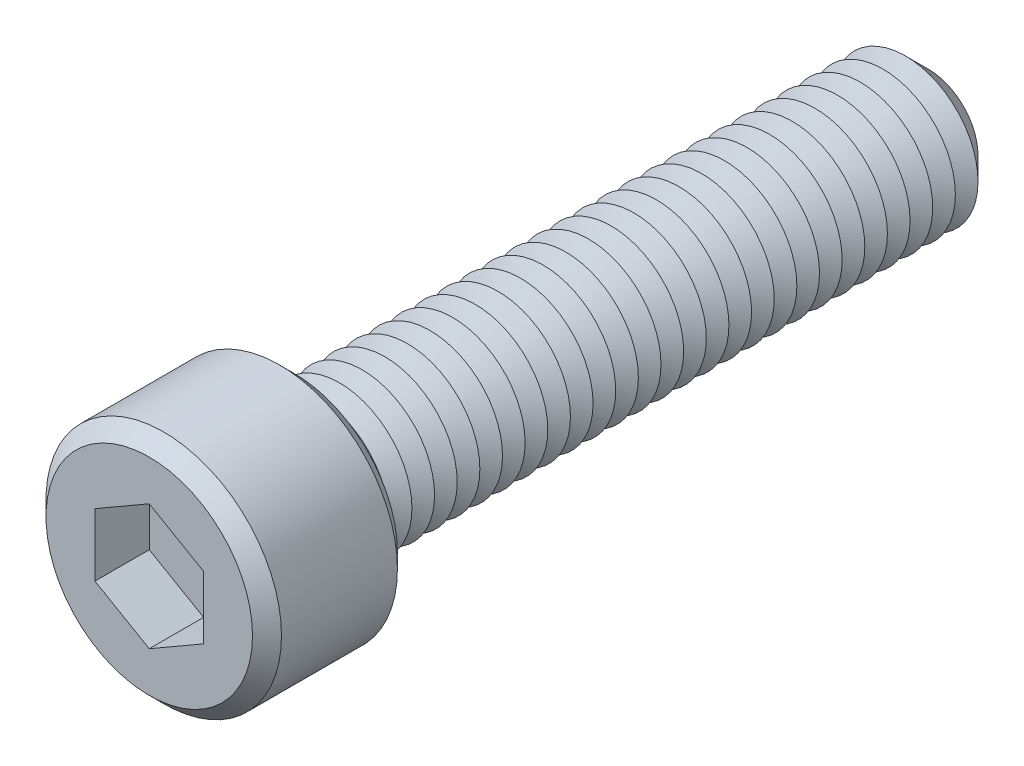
SolidWorks part; units mm, degrees
ref_plane "Front Plane" through (0, 0, 0) normal (0, 0, 1) x (1, 0, 0)
ref_plane "Top Plane" through (0, 0, 0) normal (0, 1, 0) x (1, 0, 0)
ref_plane "Right Plane" through (0, 0, 0) normal (1, 0, 0) x (0, 0, -1)
sketch "Sketch1" plane through (0, 0, 0) normal (0, 0, 1) x (1, 0, 0)
  circle A0 centre (0, 0) radius 6.5
  dimension "D1" = 13
extrude "Boss-Extrude1" add sketch "Sketch1" along normal blind 8
sketch "Sketch2" plane through (0, 0, 0) normal (0, 0, -1) x (-1, 0, 0)
  circle A0 centre (0, 0) radius 4
  dimension "D1" = 8
extrude "Boss-Extrude2" add sketch "Sketch2" along normal blind 35
chamfer "Chamfer1" distance 1.25 angle 45 1 edges at (-4, 0, -35)
sketch "Sketch3" plane through (0, 0, 0) normal (1, 0, 0) x (0, 0, -1)
  line L0 (-2.5121, 0) -> (4.5776, 0) construction
sketch "Sketch4" plane through (0, 0, 0) normal (1, 0, 0) x (0, 0, -1)
  line L0 (0, 4) -> (0.625, 2.9175)
  line L1 (0.625, 2.9175) -> (1.25, 4)
  line L2 (33.75, 4) -> (0, 4) construction
  line L3 (1.25, 4) -> (0, 4)
  dimension "D1" = 1.25
revolve "Cut-Revolve1" cut sketch "Sketch4" angle 360 about L0
pattern_linear "LPattern1" count 27 spacing 1.25 along (0, 0, -1) of "Cut-Revolve1"
sketch "Sketch5" plane through (0, 0, 8) normal (0, 0, 1) x (1, 0, 0)
  line L1 (0, 3.4641) -> (-3, 1.7321)
  line L2 (-3, 1.7321) -> (-3, -1.7321)
  line L3 (-3, -1.7321) -> (0, -3.4641)
  line L4 (0, -3.4641) -> (3, -1.7321)
  line L5 (3, -1.7321) -> (3, 1.7321)
  line L6 (3, 1.7321) -> (0, 3.4641)
  circle A0 centre (0, 0) radius 3 construction
  dimension "D1" = 6
extrude "Cut-Extrude1" cut sketch "Sketch5" against normal blind 3
sketch "Sketch6" plane through (0, 0, 5) normal (0, 0, 1) x (1, 0, 0)
  circle A0 centre (0, 0) radius 0.9
  dimension "D1" = 1.8
extrude "Cut-Extrude2" cut sketch "Sketch6" against normal up to surface (40 mm away)
chamfer "Chamfer2" distance 0.8 angle 45 2 edges at (6.5, 0, 0) (6.5, 0, 8)
